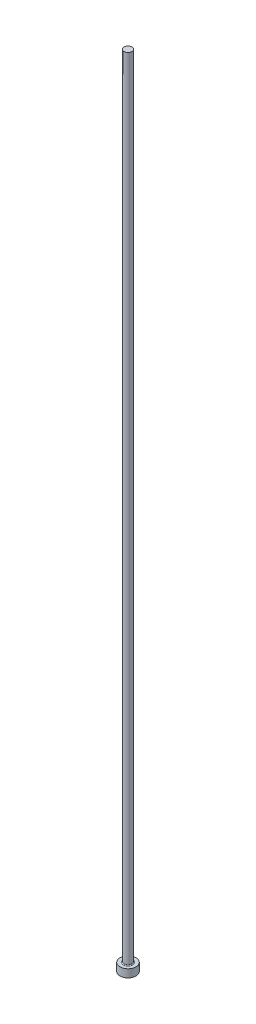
SolidWorks part; units mm, degrees
ref_plane "Plano frontal" through (0, 0, 0) normal (0, 0, 1) x (1, 0, 0)
ref_plane "Plano superior" through (0, 0, 0) normal (0, 1, 0) x (1, 0, 0)
ref_plane "Plano direito" through (0, 0, 0) normal (1, 0, 0) x (0, 0, -1)
sketch "Esboço1" plane through (0, 0, 0) normal (0, 0, 1) x (1, 0, 0)
  line L0 (0, 0) -> (2, 0)
  line L1 (2, 0) -> (2, 2)
  line L2 (2, 2) -> (1.2, 2)
  line L3 (1, 2.2) -> (1, 200)
  line L4 (1, 200) -> (0, 200)
  line L5 (0, 200) -> (0, 0) construction
  line L6 (0, 0) -> (0, 200)
  arc A0 (1.2, 2) -> (1, 2.2) centre (1.2, 2.2) cw
  dimension "D3" = 0.2
  dimension "D1" = 4
  dimension "D2" = 2
  dimension "D4" = 2
  dimension "D5" = 200
revolve "Revolução1" add sketch "Esboço1" angle 360 about L5
sketch "Esboço2"
  dimension "D1" = 1.075
  dimension "D2" = 0.35
  dimension "D3" = 0.225
  dimension "D4" = 0.15
wrap "Envolver1" sketch "Esboço2" wrap type deboss source sketch "Esboço2" thickness 0.1 parameters "D1"=0.1
